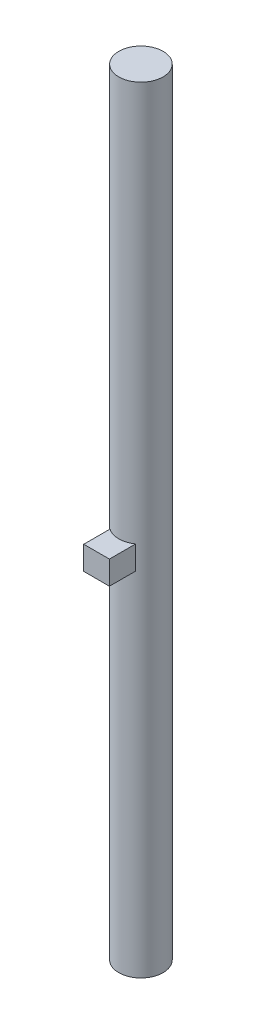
SolidWorks part; units mm, degrees
ref_plane "Front Plane" through (0, 0, 0) normal (0, 0, 1) x (1, 0, 0)
ref_plane "Top Plane" through (0, 0, 0) normal (0, 1, 0) x (1, 0, 0)
ref_plane "Right Plane" through (0, 0, 0) normal (1, 0, 0) x (0, 0, -1)
sketch "Sketch2" plane through (0, 0, 0) normal (0, 1, 0) x (1, 0, 0)
  circle A0 centre (0, 0) radius 1
  dimension "D1" = 2
extrude "Boss-Extrude1" add sketch "Sketch2" along normal blind 35
sketch "Sketch3" plane through (0, 0, 0) normal (0, 0, 1) x (1, 0, 0)
  line L1 (-0.579, 16.9511) -> (0.579, 16.9511)
  line L2 (-0.579, 16.9511) -> (-0.579, 15.8896)
  line L3 (-0.579, 15.8896) -> (0.579, 15.8896)
  line L4 (0.579, 16.9511) -> (0.579, 15.8896)
  line L5 (-0.579, 16.9511) -> (0.579, 15.8896) construction
  line L6 (-0.579, 15.8896) -> (0.579, 16.9511) construction
  point P0 (0, 16.4203)
extrude "Boss-Extrude2" add sketch "Sketch3" along normal blind 2
